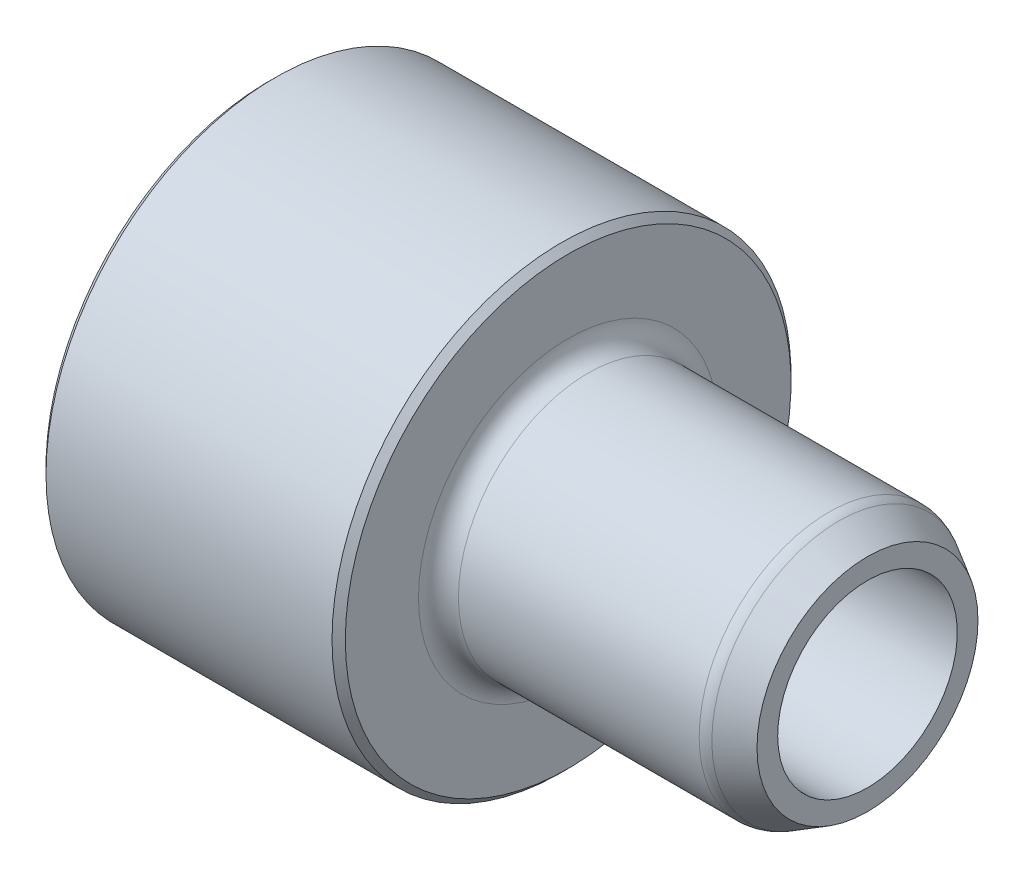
SolidWorks part; units mm, degrees
ref_plane "Plan de face" through (0, 0, 0) normal (0, 0, 1) x (1, 0, 0)
ref_plane "Plan de dessus" through (0, 0, 0) normal (0, 1, 0) x (1, 0, 0)
ref_plane "Plan de droite" through (0, 0, 0) normal (1, 0, 0) x (0, 0, -1)
sketch "Esquisse1" plane through (0, 0, 0) normal (0, 0, 1) x (1, 0, 0)
  line L0 (0, 0) -> (27.0653, 0) construction
  line L1 (0.25, 1.35) -> (5.75, 1.35)
  line L2 (5.75, 1.35) -> (5.75, 1.6613)
  line L3 (5.25, 1.95) -> (1.25, 1.95)
  line L4 (1.25, 1.95) -> (1.25, 3.45)
  line L5 (1.25, 3.45) -> (-3.25, 3.45)
  line L6 (-3.25, 3.45) -> (-3.25, 2.5)
  line L7 (-3.25, 2.5) -> (0.25, 2.5)
  line L8 (0.25, 2.5) -> (0.25, 1.35)
  line L9 (5.75, 1.6613) -> (5.25, 1.95)
  dimension "D1" = 4.5
  dimension "D2" = 0.5
  dimension "D3" = 6.9
  dimension "D4" = 3.9
  dimension "D5" = 2.7
  dimension "D6" = 5
  dimension "D7" = 1
  dimension "D8" = 150
  dimension "D9" = 4.5
  dimension "D10" = 3.25
revolve "Révolution1" add sketch "Esquisse1" angle 360 about L0
fillet "Congé1" radius 0.3 2 edges at (5.25, 0, 1.95) (1.25, 0, 1.95)
chamfer "Chanfrein1" distance 0.1 angle 45 3 edges at (-3.25, 0, 3.45) (-3.25, 0, 2.5) (1.25, 0, 3.45)
